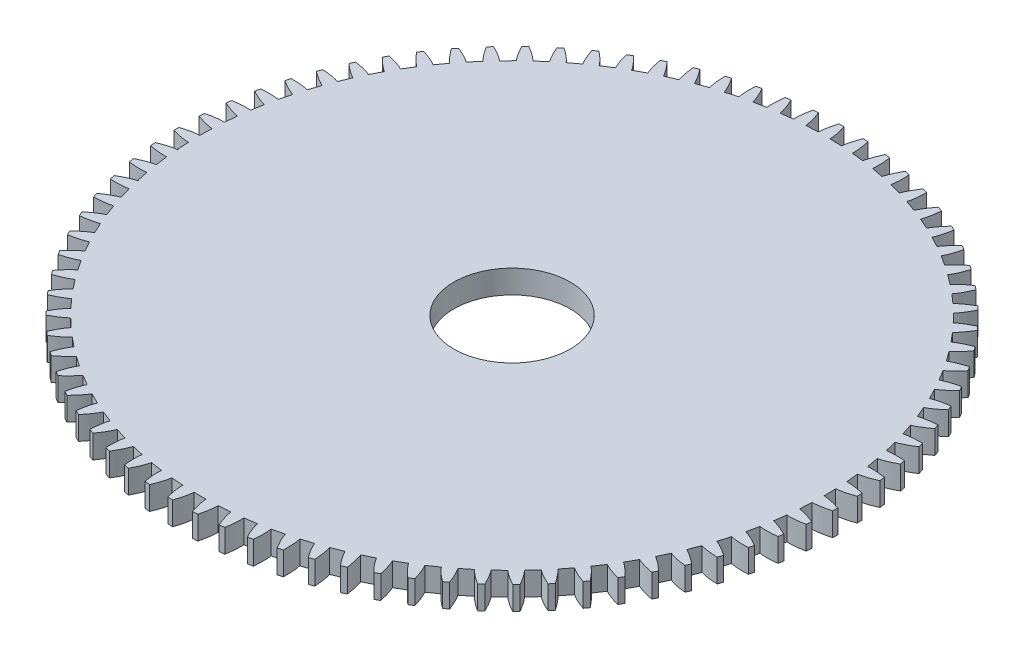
SolidWorks part; units mm, degrees
ref_plane "Front Plane" through (0, 0, 0) normal (0, 0, 1) x (1, 0, 0)
ref_plane "Top Plane" through (0, 0, 0) normal (0, 1, 0) x (1, 0, 0)
ref_plane "Right Plane" through (0, 0, 0) normal (1, 0, 0) x (0, 0, -1)
sketch "Sketch1" plane through (0, 0, 0) normal (0, 1, 0) x (1, 0, 0)
  line L0 (0, 0) -> (0, 20.0891) construction
  line L1 (0, 0) -> (-20.0891, 0) construction
  line L2 (0, 0) -> (-21.2462, -0.4021) construction
  line L3 (0, 0) -> (-20.0747, -0.7602) construction
  line L4 (0, 0) -> (-20.0315, -1.5193) construction
  circle A0 centre (0, 0) radius 20.75 construction
  circle A1 centre (0, 0) radius 20.0891 construction
  circle A2 centre (0, 0) radius 20.125 construction
  circle A3 centre (0, 0) radius 21.25 construction
  spline S0 degree 4 poles (-20.0891, 0) (-20.124, 0) (-20.2217, -0.0036) (-20.4059, -0.0245) (-20.7036, -0.0787) (-21.0772, -0.1766) (-21.5511, -0.336) (-22.0955, -0.565) (-22.6761, -0.8589) (-23.2859, -1.2223) (-23.8728, -1.6229) (-24.4361, -2.0557) (-24.9763, -2.5172) (-25.6037, -3.1082) (-26.3176, -3.8644) (-27.0911, -4.8052) (-27.893, -5.9473) (-28.6239, -7.1663) (-29.2707, -8.4319) (-29.7649, -9.5729) (-30.1385, -10.5709) (-30.4171, -11.4136) (-30.6207, -12.0944) (-30.8512, -12.9508) (-31.0504, -13.8178) (-31.2018, -14.5997) (-31.3154, -15.3042) (-31.3913, -15.8255) (-31.459, -16.3672) (-31.5144, -16.8718) (-31.561, -17.4379) (-31.596, -17.9152) (-31.6261, -18.5232) (-31.6407, -18.9378) (-31.6532, -19.6781) (-31.6471, -20.1833) (-31.6383, -20.6901) (-31.626, -20.9451) (-31.6202, -21.1099) knots 0 0 0 0 0 0.005377 0.015084 0.028532 0.04661 0.064855 0.092111 0.119476 0.146842 0.174209 0.201575 0.228941 0.256307 0.307035 0.361767 0.4165 0.471232 0.525964 0.580697 0.608063 0.635429 0.662795 0.690161 0.744894 0.77226 0.785943 0.799626 0.826992 0.854358 0.868042 0.881725 0.909091 0.931818 0.954545 0.977273 1 1 1 1 1 construction
  spline S1 degree 4 poles (-20.0891, 0) (-20.124, 0) (-20.2217, -0.0036) (-20.4059, -0.0245) (-20.7036, -0.0787) (-21.0772, -0.1766) (-21.5511, -0.336) (-22.0955, -0.565) (-22.6761, -0.8589) (-23.2859, -1.2223) (-23.8728, -1.6229) (-24.4361, -2.0557) (-24.9763, -2.5172) (-25.6037, -3.1082) (-26.3176, -3.8644) (-27.0911, -4.8052) (-27.893, -5.9473) (-28.6239, -7.1663) (-29.2707, -8.4319) (-29.7649, -9.5729) (-30.1385, -10.5709) (-30.4171, -11.4136) (-30.6207, -12.0944) (-30.8512, -12.9508) (-31.0504, -13.8178) (-31.2018, -14.5997) (-31.3154, -15.3042) (-31.3913, -15.8255) (-31.459, -16.3672) (-31.5144, -16.8718) (-31.561, -17.4379) (-31.596, -17.9152) (-31.6173, -18.3448) (-31.6274, -18.5862) (-31.6328, -18.7475) knots 0 0 0 0 0 0.005377 0.015084 0.028532 0.04661 0.064855 0.092111 0.119476 0.146842 0.174209 0.201575 0.228941 0.256307 0.307035 0.361767 0.4165 0.471232 0.525964 0.580697 0.608063 0.635429 0.662795 0.690161 0.744894 0.77226 0.785943 0.799626 0.826992 0.854358 0.868042 0.881725 0.909091 0.909091 0.909091 0.909091 0.909091
  dimension "D1" = 42.5
  dimension "D2" = 41.5
  dimension "D3" = 40.1781
  dimension "D4" = 40.25
  dimension "D5" = 20.0891
  dimension "D6" = 1.084
  dimension "D7" = 2.169
  dimension "D8" = 4.337
sketch "Sketch2" plane through (0, 0, 0) normal (0, 1, 0) x (1, 0, 0)
  line L0 (0, 0) -> (-21.2462, -0.4021) construction
  line L1 (0, 0) -> (-21.2462, -0.4021) construction
  line L2 (0, 0) -> (-20.0747, -0.7602) construction
  line L3 (0, 0) -> (-20.0891, 0) construction
  line L4 (0, 0) -> (-20.0315, -1.5193) construction
  line L5 (0, 0) -> (-20.0747, -0.7602) construction
  line L6 (0, 0) -> (-20.0891, 0) construction
  line L7 (0, 0) -> (-20.0315, -1.5193) construction
  line L8 (-20.125, 0) -> (-20.1106, -0.7616) construction
  line L9 (-20.1106, -0.7616) -> (-20.0674, -1.522)
  line L10 (-20.0674, -1.522) -> (-20.0315, -1.5193) construction
  line L11 (-20.0674, -1.522) -> (-3.7393, -0.2836)
  line L12 (-20.0891, 0) -> (-3.75, 0)
  circle A0 centre (0, 0) radius 20.125 construction
  circle A1 centre (0, 0) radius 20.0891 construction
  circle A2 centre (0, 0) radius 20.75 construction
  circle A3 centre (0, 0) radius 21.25 construction
  circle A4 centre (0, 0) radius 20.125 construction
  circle A5 centre (0, 0) radius 20.0891 construction
  circle A6 centre (0, 0) radius 20.75 construction
  circle A7 centre (0, 0) radius 21.25 construction
  arc A8 (-21.2424, -0.567) -> (-21.2487, -0.2372) centre (0, 0) cw
  circle A11 centre (0, 0) radius 3.75 construction
  arc A12 (-3.75, 0) -> (-3.7393, -0.2836) centre (0, 0) ccw
  spline S2 degree 4 poles (-20.1106, -0.7616) (-20.1181, -0.7613) (-20.202, -0.7578) (-20.3915, -0.7413) (-20.6764, -0.7003) (-20.9506, -0.6421) (-21.1482, -0.5924) (-21.2424, -0.567) knots 0.004428 0.004428 0.004428 0.004428 0.004428 0.005377 0.015084 0.028532 0.040915 0.040915 0.040915 0.040915 0.040915
  spline S3 degree 4 poles (-77.6294, -1999.0481) (-14.6603, -46.6226) (-15.9145, -1.0285) (-18.3944, 0.3413) (-20.7036, -0.0787) (-21.0772, -0.1766) (-21.5511, -0.336) (-22.0955, -0.565) (-22.6761, -0.8589) (-23.2859, -1.2223) (-23.8728, -1.6229) (-24.4361, -2.0557) (-24.9763, -2.5172) (-25.6037, -3.1082) (-26.3176, -3.8644) (-27.0911, -4.8052) (-27.893, -5.9473) (-28.6239, -7.1663) (-29.2707, -8.4319) (-29.7649, -9.5729) (-30.1385, -10.5709) (-30.4171, -11.4136) (-30.6207, -12.0944) (-30.8512, -12.9508) (-31.0504, -13.8178) (-31.2018, -14.5997) (-31.3154, -15.3042) (-31.3913, -15.8255) (-31.459, -16.3672) (-31.5144, -16.8718) (-31.561, -17.4379) (-31.7379, -19.8523) (-31.8027, -27.7041) (-28.1848, 68.1726) (-96.9382, -2017.4378) knots -0.315 -0.315 -0.315 -0.315 -0.315 0.005377 0.015084 0.028532 0.04661 0.064855 0.092111 0.119476 0.146842 0.174209 0.201575 0.228941 0.256307 0.307035 0.361767 0.4165 0.471232 0.525964 0.580697 0.608063 0.635429 0.662795 0.690161 0.744894 0.77226 0.785943 0.799626 0.826992 0.854358 0.868042 0.881725 1.242305 1.242305 1.242305 1.242305 1.242305 only from (-20.0891, 0) to (-31.6328, -18.7475) construction
  spline S4 degree 4 poles (-20.0891, 0) (-20.124, 0) (-20.2217, -0.0036) (-20.4059, -0.0245) (-20.6982, -0.0777) (-20.9521, -0.1438) (-21.1425, -0.2021) (-21.2487, -0.2372) knots 0 0 0 0 0 0.005377 0.015084 0.028532 0.045772 0.045772 0.045772 0.045772 0.045772
  point P18 (-20.1178, -0.3808)
  point P24 (-20.0674, -1.522)
  dimension "D2" = 7.5
extrude "Boss-Extrude1" add sketch "Sketch2" along normal blind 1.5
pattern_circular "CirPattern1" count 83 over 360 of "Boss-Extrude1"
sketch "Sketch3" plane through (0, 0, 0) normal (0, -1, 0) x (-1, 0, 0)
  circle A0 centre (0, 12) radius 1
  dimension "D1" = 2
  dimension "D2" = 12
extrude "Boss-Extrude2" add sketch "Sketch3" along normal blind 6 contours A0
sketch "Sketch4" plane through (0, 0, 0) normal (0, -1, 0) x (1, 0, 0)
  circle A0 centre (0, -12) radius 2
  dimension "D1" = 4
extrude "Boss-Extrude3" add sketch "Sketch4" along normal blind 4.5 contours A0
equation "\"Module\"= .5"
equation "\"Number of Teeth\"= 83"
equation "\"Pressure Angle\"= 14.5deg"
equation "\"Pitch Diameter\"= \"Number of Teeth\" * \"Module\""
equation "\"Circular Pitch\"= pi * \"Module\""
equation "\"Addendum\"= \"Module\""
equation "\"Dedendum\"= 1.25 * \"Module\""
equation "\"Base Diameter\"= \"Pitch Diameter\" * cos ( \"Pressure Angle\" )"
equation "\"Base Radius\"= \"Base Diameter\" / 2"
equation "\"Width\"= 1.5mm"
equation "\"Outside Diameter\"= \"Pitch Diameter\" + 2 * \"Addendum\""
equation "\"D1@Sketch1\"=\"Outside Diameter\""
equation "\"D3@Sketch1\"=\"Base Diameter\""
equation "\"Root Diameter\"= \"Pitch Diameter\" - 2 * \"Dedendum\""
equation "\"D4@Sketch1\"=\"Root Diameter\""
equation "\"Tooth Angle\"= 360 / \"Number of Teeth\""
equation "\"D6@Sketch1\"=\"Tooth Angle\"/4"
equation "\"D7@Sketch1\"=\"Tooth Angle\"/2"
equation "\"D8@Sketch1\"=\"Tooth Angle\""
equation "\"D2@Sketch1\" = \"Pitch Diameter\""
equation "\"Shaft Diameter\"= 7.5"
equation "\"D1@CirPattern1\" = \"Number of Teeth\""
equation "\"D2@Sketch2\"  = \"Shaft Diameter\""
equation "\"D1@Boss-Extrude1\" = \"Width\""
